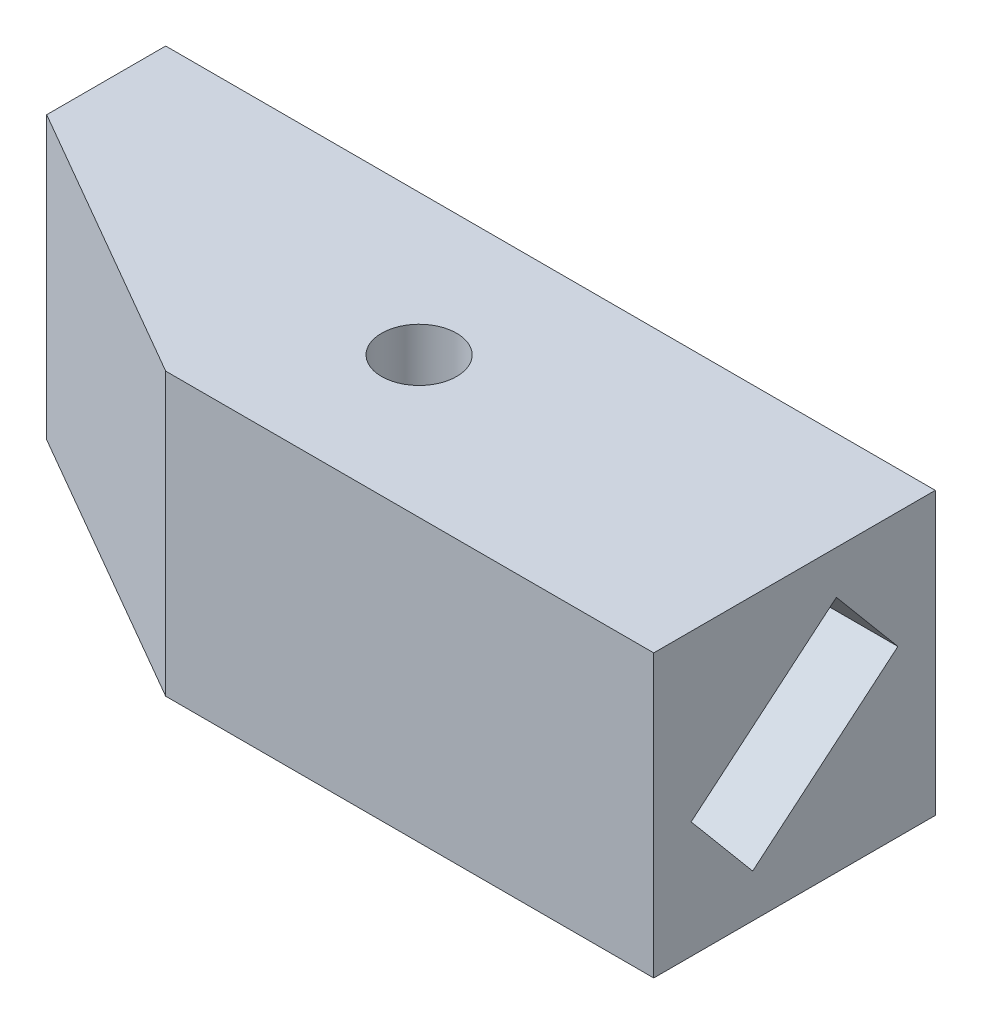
SolidWorks part; units mm, degrees
ref_plane "Спереди" through (0, 0, 0) normal (0, 0, 1) x (1, 0, 0)
ref_plane "Сверху" through (0, 0, 0) normal (0, 1, 0) x (1, 0, 0)
ref_plane "Справа" through (0, 0, 0) normal (1, 0, 0) x (0, 0, -1)
sketch "Эскиз1" plane through (0, 0, 0) normal (0, 1, 0) x (1, 0, 0)
  line L0 (-20, 15) -> (-35, 15)
  line L1 (-20, -15) -> (20, -15)
  line L2 (-35, 15) -> (-35, -15)
  line L3 (-20, 15) -> (20, 15)
  line L4 (20, -15) -> (20, 15)
  line L5 (-20, -15) -> (20, 15) construction
  line L6 (-20, 15) -> (20, -15) construction
  line L7 (-35, -15) -> (-20, -15)
  point P0 (0, 0)
  dimension "D1" = 40
  dimension "D2" = 30
  dimension "D3" = 15
extrude "Бобышка-Вытянуть1" add sketch "Эскиз1" along normal blind 30
sketch "Эскиз2" plane through (0, 30, 0) normal (0, 1, 0) x (1, 0, 0)
  line L0 (-20, -15) -> (-20, 15) construction
  circle A0 centre (-20, 0) radius 4
  dimension "D1" = 15
extrude "Вырез-Вытянуть1" cut sketch "Эскиз2" against normal through all
sketch "Эскиз5" plane through (20, 0, 0) normal (1, 0, 0) x (0, 0, -1)
  line L0 (0, 30) -> (0, 0) construction
  line L1 (-15, 30) -> (15, 0) construction
  line L2 (-15, 0) -> (15, 0) construction
  line L4 (11.0153, 17.5853) -> (4.4588, 25.399)
  line L5 (11.0153, 17.5853) -> (-4.4588, 4.601)
  line L6 (-4.4588, 4.601) -> (-11.0153, 12.4147)
  line L7 (4.4588, 25.399) -> (-11.0153, 12.4147)
  line L8 (11.0153, 17.5853) -> (-11.0153, 12.4147) construction
  line L9 (-4.4588, 4.601) -> (4.4588, 25.399) construction
  point P5 (0, 15)
  point P6 (0, 15)
  dimension "D1" = 20.2
  dimension "D2" = 10.2
  dimension "D3" = 40
extrude "Вырез-Вытянуть4" cut sketch "Эскиз5" against normal blind 30
sketch "Sketch1" plane through (-35, 0, 0) normal (-1, 0, 0) x (0, 0, 1)
  line L0 (0, 30) -> (0, 0) construction
  line L1 (-15, 30) -> (15, 30) construction
  line L2 (-15, 0) -> (15, 0) construction
  line L4 (-15, 0) -> (15, 0)
  line L5 (-15, 0) -> (-15, 30)
  line L6 (-15, 30) -> (15, 30)
  line L7 (15, 0) -> (15, 30)
  line L8 (-15, 0) -> (15, 30) construction
  line L9 (-15, 30) -> (15, 0) construction
  point P6 (0, 15)
extrude "Boss-Extrude1" add sketch "Sketch1" along normal blind 27
chamfer "Chamfer1" distance 30 angle 30 1 edges at (-62, 15, 15)
